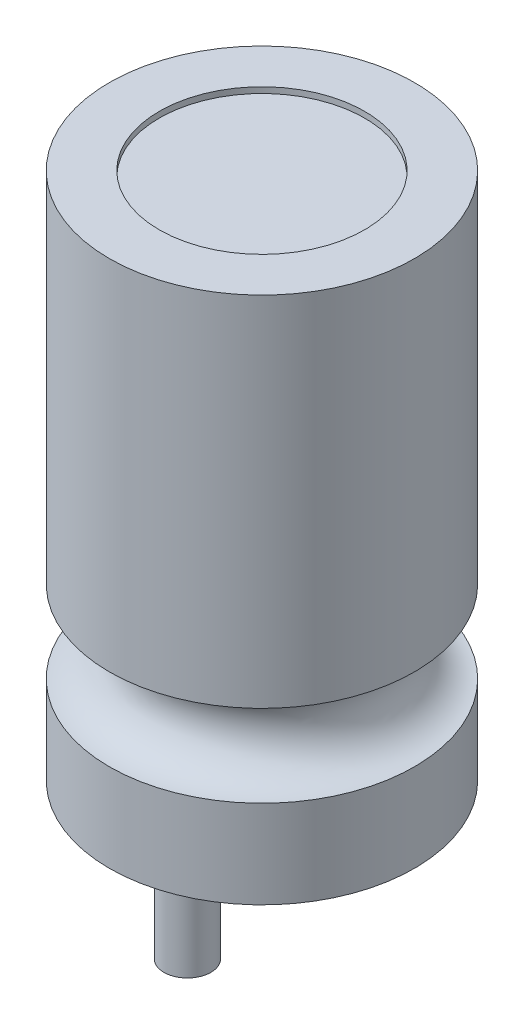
SolidWorks part; units mm, degrees
ref_plane "Face" through (0, 0, 0) normal (0, 0, 1) x (1, 0, 0)
ref_plane "Dessus" through (0, 0, 0) normal (0, 1, 0) x (1, 0, 0)
ref_plane "Droite" through (0, 0, 0) normal (1, 0, 0) x (0, 0, -1)
sketch "Esquisse1" plane through (0, 0, 0) normal (0, 0, 1) x (1, 0, 0)
  line L0 (0, 48.4017) -> (0, -33.7592) construction
  line L1 (0, 36.5164) -> (2.6, 36.5164)
  line L2 (2.6, 36.5164) -> (2.6, 30.4164)
  line L3 (2.6, 29.0164) -> (2.6, 27.5164)
  line L4 (2.6, 27.5164) -> (0, 27.5164)
  line L5 (0, 27.5164) -> (0, 36.5164)
  line L6 (9.8114, 29.7164) -> (-7.1309, 29.7164) construction
  line L7 (2.6, 25.0819) -> (2.6, 32.6721) construction
  line L8 (5.1241, 27.5164) -> (-5.6865, 27.5164) construction
  line L9 (5.1241, 29.0164) -> (-3.1767, 29.0164) construction
  arc A0 (2.6, 30.4164) -> (2.6, 29.0164) centre (2.6, 29.7164) ccw
  dimension "D4" = 0.7
  dimension "D1" = 9
  dimension "D2" = 2.6
  dimension "D3" = 1.5
revolve "Révolution1" add sketch "Esquisse1" angle 360 about L0
sketch "Esquisse2" plane through (0, 36.5164, 0) normal (0, 1, 0) x (-1, 0, 0)
  circle A0 centre (0, 0) radius 1.75
  dimension "D1" = 3.5
extrude "Enlèv. mat.-Extru.1" cut sketch "Esquisse2" against normal blind 0.1
sketch "Esquisse3" plane through (0, 27.5164, 0) normal (0, -1, 0) x (1, 0, 0)
  line L0 (4.0351, 0) -> (-4.283, 0) construction
  line L1 (0, 6.7464) -> (0, -6.9013) construction
  line L2 (4.0351, 1.27) -> (-0.9275, 1.27) construction
  circle A0 centre (0, 1.27) radius 0.4
  circle A1 centre (0, -1.27) radius 0.4
  dimension "D2" = 1.27
extrude "Boss.-Extru.1" add sketch "Esquisse3" along normal blind 2
